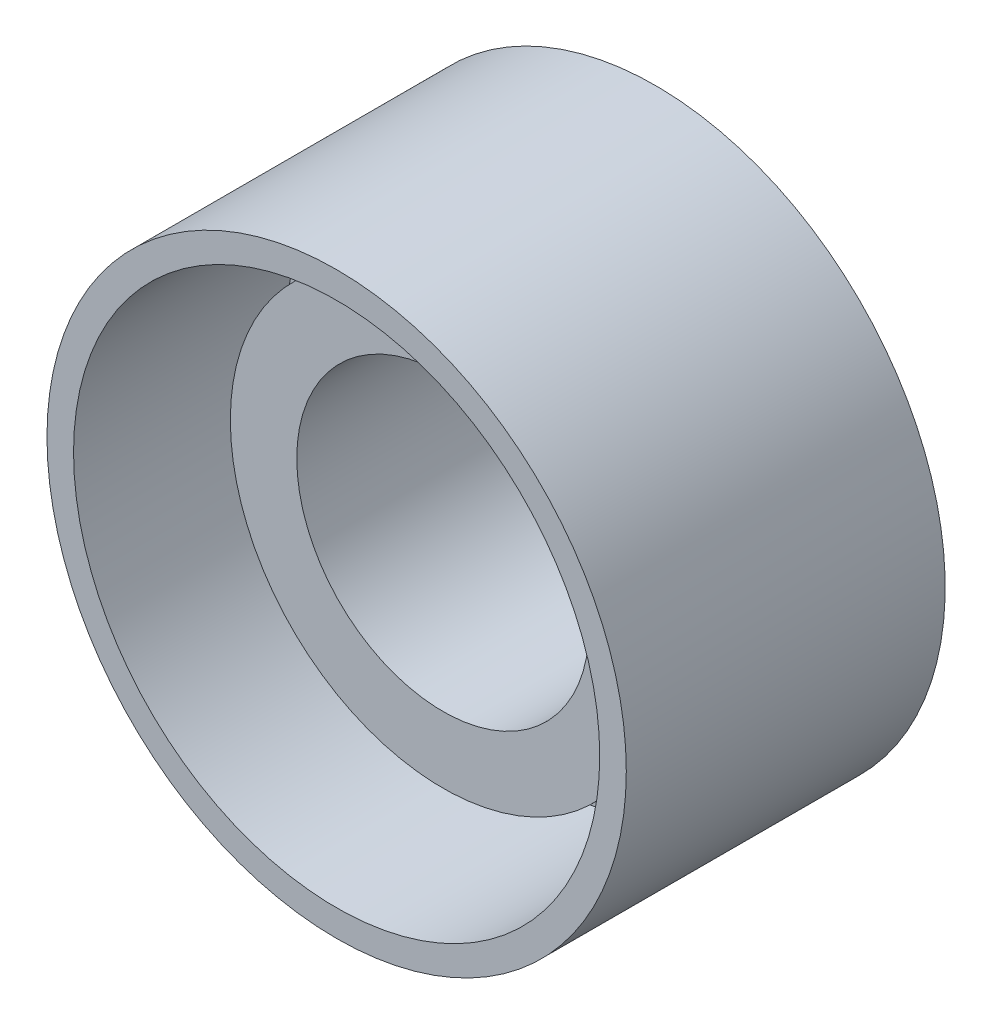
SolidWorks part; units mm, degrees
ref_plane "前视基准面" through (0, 0, 0) normal (0, 0, 1) x (1, 0, 0)
ref_plane "上视基准面" through (0, 0, 0) normal (0, 1, 0) x (1, 0, 0)
ref_plane "右视基准面" through (0, 0, 0) normal (1, 0, 0) x (0, 0, -1)
sketch "草图1" plane through (0, 0, 0) normal (0, 0, 1) x (1, 0, 0)
  circle A0 centre (0, 0) radius 54.5
  circle A1 centre (0, 0) radius 49.5
  dimension "D1" = 109
  dimension "D2" = 99
extrude "拉伸1" add sketch "草图1" along normal blind 40
sketch "草图2" plane through (0, 0, 0) normal (0, 0, 1) x (1, 0, 0)
  circle A0 centre (0, 0) radius 40
  dimension "D1" = 80
extrude "拉伸2" add sketch "草图2" along normal blind 20
sketch "草图3" plane through (0, 0, 0) normal (0, 0, -1) x (-1, 0, 0)
  circle A0 centre (0, 0) radius 54.5
extrude "拉伸3" add sketch "草图3" along normal blind 20
sketch "草图4" plane through (0, 0, -20) normal (0, 0, -1) x (-1, 0, 0)
  circle A0 centre (0, 0) radius 27.5
  dimension "D1" = 55
extrude "切除-拉伸1" cut sketch "草图4" against normal through all
